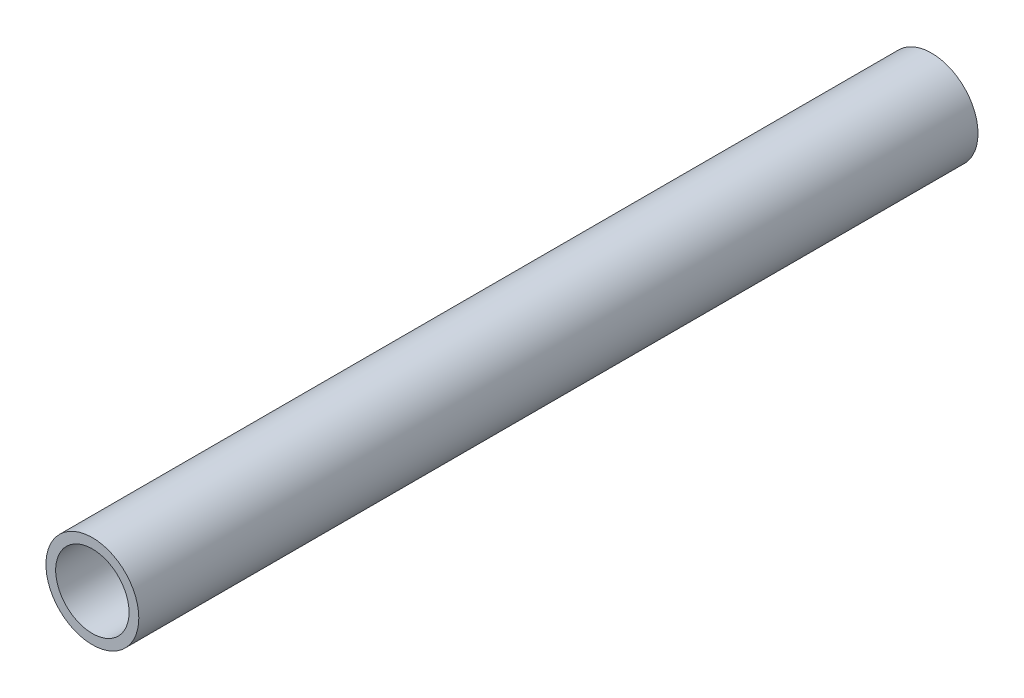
SolidWorks part; units mm, degrees
ref_plane "Front Plane" through (0, 0, 0) normal (0, 0, 1) x (1, 0, 0)
ref_plane "Top Plane" through (0, 0, 0) normal (0, 1, 0) x (1, 0, 0)
ref_plane "Right Plane" through (0, 0, 0) normal (1, 0, 0) x (0, 0, -1)
sketch "Sketch1" plane through (0, 0, 0) normal (0, 0, 1) x (1, 0, 0)
  line L0 (13.489, 0) -> (16.8672, 0) construction
  circle A0 centre (0, 0) radius 16.8672
  circle A1 centre (0, 0) radius 13.3223
sketch "Sketch2" plane through (0, 0, 0) normal (1, 0, 0) x (0, 0, -1)
  line L0 (-152.4, 16.8672) -> (152.4, 16.8672)
  line L1 (-118.6656, -16.8672) -> (118.6656, -16.8672) construction
  point P2 (0, 16.8672)
  point P7 (0, -16.8672)
  point P8 (-111.9187, -16.8672)
  point P13 (-141.2677, -16.8672)
sketch "Sketch3" plane through (0, 0, 0) normal (0, 0, 1) x (1, 0, 0)
  circle A0 centre (0, 0) radius 16.8672
  circle A1 centre (0, 0) radius 13.3223
  circle A2 centre (0, 0) radius 16.8672 construction
  circle A3 centre (0, 0) radius 13.3223 construction
extrude "Boss-Extrude1" add sketch "Sketch3" against normal up to vertex (152.4 mm away) and the other way up to vertex (152.4 mm away)
equation "\"Break Line@Sketch2\" = \"OD@Sketch1\""
equation "\"Pipe Note@Sketch2\"=\"Break Line@Sketch2\"*.33"
equation "\"Break Line 2@Sketch2\"=\"Break Line@Sketch2\"*1.2"
